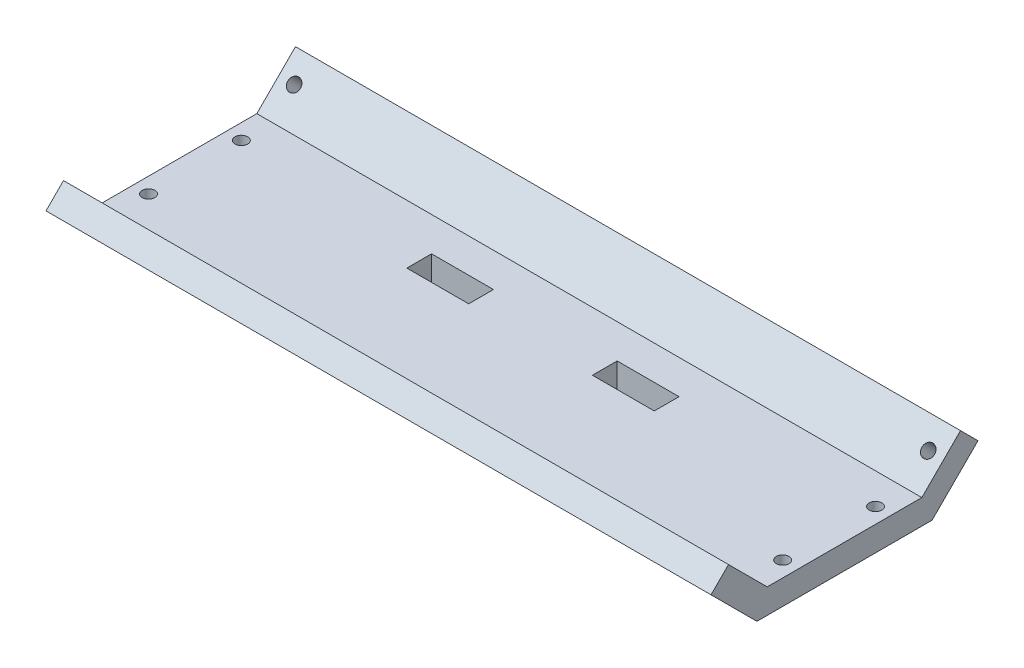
SolidWorks part; units mm, degrees
ref_plane "Front Plane" through (0, 0, 0) normal (0, 0, 1) x (1, 0, 0)
ref_plane "Top Plane" through (0, 0, 0) normal (0, 1, 0) x (1, 0, 0)
ref_plane "Right Plane" through (0, 0, 0) normal (1, 0, 0) x (0, 0, -1)
sketch "Sketch2" plane through (0, 0, 0) normal (1, 0, 0) x (0, 0, -1)
  line L0 (-25, 0) -> (25, 0)
  line L1 (25, 0) -> (37.5, 12.5)
  line L2 (-25, 0) -> (-37.5, 12.5)
  line L8 (28.3137, -8) -> (43.1569, 6.8431)
  line L9 (-28.3137, -8) -> (28.3137, -8)
  line L10 (-28.3137, -8) -> (-43.1569, 6.8431)
  line L11 (-37.5, 12.5) -> (-43.1569, 6.8431)
  line L12 (37.5, 12.5) -> (43.1569, 6.8431)
  line L13 (-37.5, 12.5) -> (-50, 25) construction
  line L14 (37.5, 12.5) -> (50, 25) construction
  point P4 (0, 0)
extrude "Main" add sketch "Sketch2" along normal mid plane 215
hole_wizard "Ø4.0mm Dowel Hole2" positions "3DSketch2" profile "Sketch4" hole size "Ø4.0" standard "ANSI Metric"
sketch3d "3DSketch2"
  line L2 (107.5, 0, -25) -> (-107.5, 0, -25) construction
  line L3 (-102.5, 0, -25) -> (-102.5, 0, -15) construction
  line L4 (-102.5, 0, -15) -> (-102.5, 0, 15) construction
  line L5 (-102.5, 0, 15) -> (-102.5, 0, 25) construction
  line L6 (107.5, 0, 25) -> (-107.5, 0, 25) construction
  line L11 (102.5, 0, -25) -> (102.5, 0, -15) construction
  line L12 (102.5, 0, -15) -> (102.5, 0, 15) construction
  line L13 (102.5, 0, 15) -> (102.5, 0, 25) construction
  line L27 (102.5, 0, -25) -> (102.5, 7.0711, -32.0711) construction
  line L29 (102.5, 0, 25) -> (102.5, 7.0711, 32.0711) construction
  line L31 (-102.5, 7.0711, 32.0711) -> (-102.5, 0, 25) construction
  line L35 (-102.5, 7.0711, -32.0711) -> (-107.5, 7.0711, -32.0711) construction
  line L36 (-107.5, 12.5, -37.5) -> (-107.5, 0, -25) construction
  line L38 (-102.5, 7.0711, 32.0711) -> (-107.5, 7.0711, 32.0711) construction
  line L39 (-107.5, 0, 25) -> (-107.5, 12.5, 37.5) construction
  line L41 (102.5, 7.0711, -32.0711) -> (107.5, 7.0711, -32.0711) construction
  line L42 (107.5, 12.5, -37.5) -> (107.5, 0, -25) construction
  line L44 (102.5, 7.0711, 32.0711) -> (107.5, 7.0711, 32.0711) construction
  line L45 (107.5, 0, 25) -> (107.5, 12.5, 37.5) construction
  line L47 (102.5, 0, 25) -> (107.5, 0, 25) construction
  line L49 (-102.5, 0, 25) -> (-107.5, 0, 25) construction
  line L51 (-102.5, 7.0711, -32.0711) -> (-102.5, 0, -25) construction
  point P0 (-102.5, 7.0711, -32.0711)
  point P2 (-102.5, 0, -15)
  point P4 (-102.5, 0, 15)
  point P6 (-102.5, 7.0711, 32.0711)
  point P8 (102.5, 7.0711, 32.0711)
  point P10 (102.5, 0, 15)
  point P12 (102.5, 0, -15)
  point P14 (102.5, 7.0711, -32.0711)
  dimension "D1" = 5
  dimension "D2" = 10
  dimension "D3" = 10
sketch "Sketch4" plane through (-102.5, 7.0711, -32.0711) normal (1, 0, 0) x (0, -0.7071, 0.7071)
  line L0 (0, 0) -> (0, 18.4957)
  line L1 (0, 18.4957) -> (2.05, 18.4957)
  line L2 (2.05, 18.4957) -> (2.05, 0)
  line L5 (2.05, 0) -> (0, 0)
  line L11 (0, -6.35) -> (0, 107.95) construction
  dimension "Thru Hole Dia." = 4.1
  dimension "Thru Hole Depth" = 18.4957
sketch "Sketch5" plane through (0, 0, 0) normal (0, 1, 0) x (1, 0, 0)
  line L1 (-33.5, 21) -> (33.5, 21) construction
  line L2 (-33.5, 21) -> (-33.5, -21) construction
  line L3 (-33.5, -21) -> (33.5, -21) construction
  line L4 (33.5, 21) -> (33.5, -21) construction
  line L5 (-33.5, 21) -> (33.5, -21) construction
  line L6 (-33.5, -21) -> (33.5, 21) construction
  circle A0 centre (-33.5, 21) radius 3.5
  circle A1 centre (33.5, 21) radius 3.5
  circle A2 centre (-33.5, -21) radius 3.5
  circle A3 centre (33.5, -21) radius 3.5
  circle A4 centre (-33.5, 21) radius 1.55
  circle A5 centre (33.5, 21) radius 1.55
  circle A6 centre (33.5, -21) radius 1.55
  circle A7 centre (-33.5, -21) radius 1.55
  point P0 (0, 0)
  dimension "D1" = 7
  dimension "D2" = 3.1
  dimension "D3" = 42
  dimension "D4" = 67
extrude "Boss-Extrude1" [suppressed] add sketch "Sketch5" along normal blind 12
sketch "Sketch6" plane through (0, 0, 0) normal (0, 1, 0) x (1, 0, 0)
  line L0 (0, 0) -> (0, 10) construction
  line L1 (20, 14) -> (40, 14)
  line L2 (20, 14) -> (20, 6)
  line L3 (20, 6) -> (40, 6)
  line L4 (40, 14) -> (40, 6)
  line L5 (20, 14) -> (40, 6) construction
  line L6 (20, 6) -> (40, 14) construction
  line L7 (30, 10) -> (0, 10) construction
  line L8 (-40, 14) -> (-20, 14)
  line L9 (-40, 14) -> (-40, 6)
  line L10 (-40, 6) -> (-20, 6)
  line L11 (-20, 14) -> (-20, 6)
  line L12 (-40, 14) -> (-20, 6) construction
  line L13 (-40, 6) -> (-20, 14) construction
  line L14 (0, 10) -> (-30, 10) construction
  point P0 (30, 10)
  point P5 (-30, 10)
extrude "Shelf cut" cut sketch "Sketch6" against normal through all
equation "\"length\" = 215mm"
equation "\"D1@Main\" = \"length\""
equation "\"width\" = 220mm"
equation "\"height\" = 100mm"
equation "\"skin_th\" = 8mm"
equation "\"D5@Sketch2\"=\"skin_th\""
equation "\"D1@Sketch2\"=\"height\""
equation "\"shelf_height\" = 10mm"
equation "\"D4@Sketch6\"=\"shelf_height\""
equation "\"D2@Sketch6\"=\"skin_th\""
